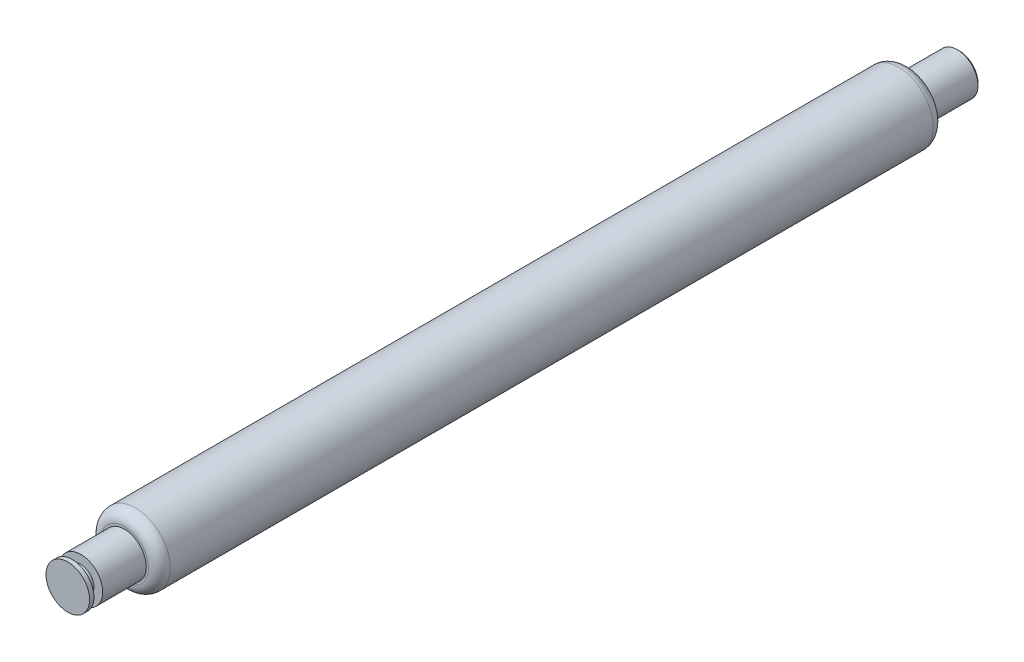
SolidWorks part; units mm, degrees
ref_plane "Front" through (0, 0, 0) normal (0, 0, 1) x (1, 0, 0)
ref_plane "Top" through (0, 0, 0) normal (0, 1, 0) x (1, 0, 0)
ref_plane "Right" through (0, 0, 0) normal (1, 0, 0) x (0, 0, -1)
sketch "Esquisse1" plane through (0, 0, 0) normal (0, 0, 1) x (1, 0, 0)
  circle A0 centre (0, 0) radius 8
  dimension "D1" = 16
extrude "Boss.-Extru.1" add sketch "Esquisse1" along normal blind 180
sketch "Esquisse2" plane through (0, 0, 0) normal (0, 0, -1) x (-1, 0, 0)
  circle A0 centre (0, 0) radius 4.75
  dimension "D1" = 9.5
extrude "Boss.-Extru.2" add sketch "Esquisse2" along normal blind 11.5
fillet "Congé1" radius 2.5 2 edges at (8, 0, 180) (8, 0, 0)
sketch "Esquisse4" plane through (0, 0, -11.5) normal (0, 0, -1) x (-1, 0, 0)
  circle A0 centre (0, 0) radius 3
  dimension "D1" = 6
extrude "Enlèv. mat.-Extru.1" cut sketch "Esquisse4" against normal blind 50
shell "Coque1" thickness 2
sketch "Esquisse3" plane through (0, 0, 0) normal (1, 0, 0) x (0, 0, -1)
  line L0 (-180, 0) -> (-205.7409, 0) construction
  line L1 (-180, 5.5) -> (-180, -5.5) construction
  line L2 (-180, 0) -> (-180, 5)
  line L3 (-180, 5) -> (-190, 5)
  line L4 (-190, 5) -> (-190, 3)
  line L5 (-190, 3) -> (-192, 3)
  line L6 (-192, 3) -> (-192, 5)
  line L7 (-192, 5) -> (-193, 5)
  line L8 (-193, 5) -> (-193, 0)
  line L9 (-193, 0) -> (-180, 0)
  dimension "D1" = 10
  dimension "D2" = 13
  dimension "D3" = 1
  dimension "D4" = 2
  dimension "D5" = 6
revolve "Révolution1" add sketch "Esquisse3" angle 360 about L0
chamfer "Chanfrein1" distance 0.5 angle 45 2 edges at (-3, 0, -11.5) (-4.75, 0, -11.5)
